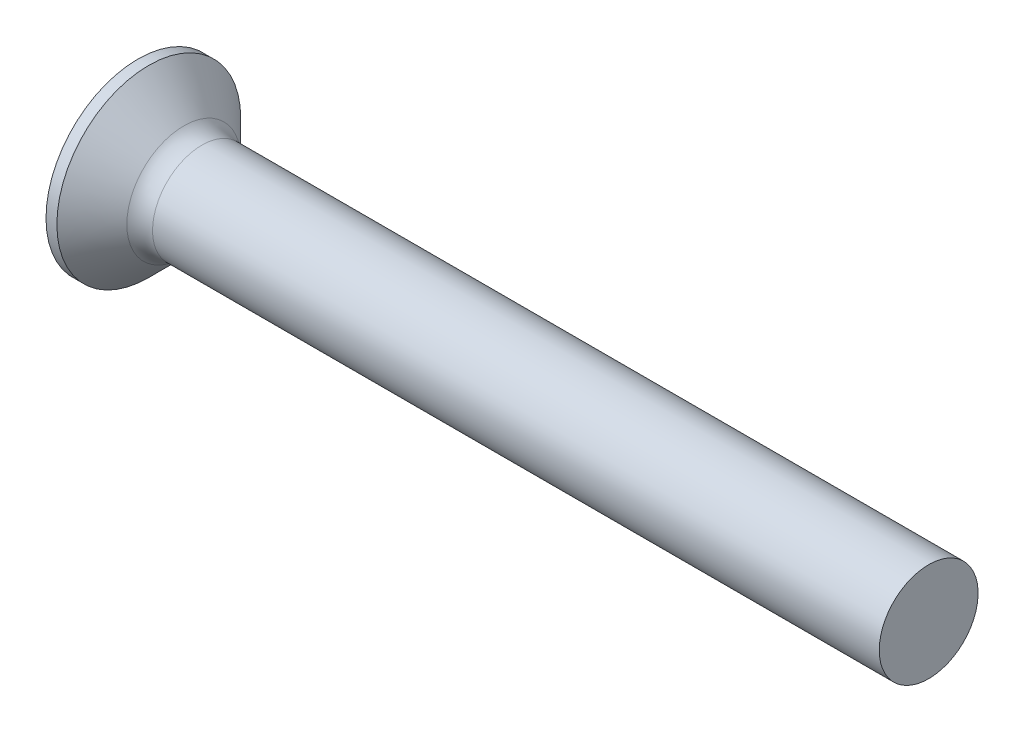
SolidWorks part; units mm, degrees
ref_plane "Plane1" through (0, 0, 0) normal (0, 0, 1) x (1, 0, 0)
ref_plane "Plane2" through (0, 0, 0) normal (0, 1, 0) x (1, 0, 0)
ref_plane "Plane3" through (0, 0, 0) normal (1, 0, 0) x (0, 0, -1)
sketch "BodySke" plane through (0, 0, 0) normal (0, 0, 1) x (1, 0, 0)
  line L0 (0, 0) -> (0, 4.65)
  line L1 (0, 4.65) -> (0.55, 4.65)
  line L2 (2.7, 2.5) -> (40, 2.5)
  line L3 (40, 2.5) -> (40, 0)
  line L4 (40, 0) -> (0, 0)
  line L5 (-6.35, 0) -> (82.55, 0) construction
  line L6 (2.7, -2.5) -> (40, -2.5) construction
  line L7 (0.55, -4.65) -> (2.7, -2.5) construction
  line L8 (0.55, 4.65) -> (2.7, 2.5)
  line L9 (0, -4.65) -> (0.55, -4.65) construction
  line L10 (3.5, 4.0875) -> (3.5, -5.4375) construction
  line L11 (0, 6.35) -> (0, -3.175) construction
  dimension "Diameter" = 5
  dimension "Length" = 40
  dimension "Head_ht" = 2.7
  dimension "Head_dia" = 9.3
  dimension "Head_ang" = 90
  dimension "D6" = 0.55
  dimension "Advance" = 0.8
  dimension "Thread_nom" = 40
revolve "Base-Revolve" add sketch "BodySke"
fillet "Fillet1" radius 1.3 1 edges at (2.7, 0, 2.5)
sketch "Sketch3" plane through (0, 0, 0) normal (-1, 0, 0) x (0, 0, 1)
  line L0 (-0.515, 2.45) -> (0.515, 2.45)
  line L1 (0.515, 2.45) -> (0.515, -2.45)
  line L2 (0.515, -2.45) -> (-0.515, -2.45)
  line L3 (-0.515, -2.45) -> (-0.515, 2.45)
  dimension "D1" = 2.45
  dimension "Cross_dia" = 4.9
  dimension "D2" = 0.515
  dimension "Cross_width" = 1.03
ref_plane "Plane4" through (3.05, 0, 0) normal (-1, 0, 0) x (0, 0, 1)
sketch "Sketch4" plane through (3.05, 0, 0) normal (-1, 0, 0) x (0, 0, 1)
  line L0 (-0.515, 0.9293) -> (0.515, 0.9293)
  line L3 (0.515, 0.9293) -> (0.515, -0.9293)
  line L4 (0.515, -0.9293) -> (-0.515, -0.9293)
  line L5 (-0.515, -0.9293) -> (-0.515, 0.9293)
  dimension "D1" = 1.03
  dimension "D2" = 1.8587
  dimension "D3" = 0.515
  dimension "D4" = 0.9293
loft "Recess" cut profiles "Sketch3", "Sketch4"
pattern_circular "RecPat" count 2 every 90 about axis through (0, 0, 0) along (1, 0, 0) of "Recess"
sketch "RecCorSke" plane through (0, 0, 0) normal (0, 0, 1) x (1, 0, 0)
  line L0 (-3.175, 0) -> (15.875, 0) construction
  line L2 (0, 0) -> (0, 1.0643)
  line L3 (0, 1.0643) -> (3.05, 0.851)
  line L4 (3.05, 0.851) -> (3.3265, 0)
  line L5 (3.3265, 0) -> (0, 0)
  dimension "Diameter" = 1.702
  dimension "Depth" = 3.05
  dimension "Draft_angle" = 4
  dimension "Bottom_angle" = 18
revolve "RecessCore" cut sketch "RecCorSke" angle 360 about L0
sketch "ThdSchSke" plane through (0, 0, 0) normal (0, 0, 1) x (1, 0, 0)
  line L0 (3.5, -2.055) -> (3.1884, -2.5)
  line L1 (3.5, -2.055) -> (3.8116, -2.5)
  line L2 (3.8116, -2.5) -> (3.8116, -3.125)
  line L3 (-3.175, 0) -> (5.1513, 0) construction
  line L5 (3.8116, -3.125) -> (3.1884, -3.125)
  line L6 (3.1884, -3.125) -> (3.1884, -2.5)
  line L7 (0, 4.65) -> (0, -4.65) construction
  dimension "Thread_minor" = 4.11
  dimension "Diameter" = 5
  dimension "Start" = 3.5
  dimension "SideAngle" = 55
  dimension "VeeAngle" = 70
  dimension "Overcut" = 6.25
revolve "ThreadSchematic" [suppressed] cut sketch "ThdSchSke" angle 360 about L3
pattern_linear "ThdSchPat" [suppressed]
equation "\"D1@Sketch3\" = \"Cross_dia@Sketch3\" / 2"
equation "\"D2@Sketch3\" = \"Cross_width@Sketch3\" / 2"
equation "\"Depth@RecCorSke\" = \"Cross_depth@Plane4\""
equation "\"D1@Sketch4\" = \"Cross_width@Sketch3\""
equation "\"D2@Sketch4\" = \"Cross_dia@Sketch3\" - 2.0 * \"Cross_depth@Plane4\" * tan(26.5  * 0.017453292)"
equation "\"D3@Sketch4\" = \"D1@Sketch4\" / 2"
equation "\"D4@Sketch4\" = \"D2@Sketch4\" / 2"
equation "\"Thread_length@ThreadCosmetic\" = ((sgn( (\"Length@BodySke\" - \"Advance@BodySke\" * 1.0 - \"Head_ht@BodySke\" ) - \"Thread_nom@BodySke\" )-1)*( (\"Length@BodySke\" - \"Advance@BodySke\" * 1.0 - \"Head_ht@BodySke\" "
equation "\"Thread_minor@ThdSchSke\" = \"Thread_minor@ThreadCosmetic\""
equation "\"Diameter@ThdSchSke\" = \"Diameter@BodySke\""
equation "\"Overcut@ThdSchSke\" = \"Diameter@BodySke\" * 1.25"
equation "\"Start@ThdSchSke\" = 0.000001 + \"Length@BodySke\" - \"Thread_length@ThreadCosmetic\"  '---Countersunk---"
equation "\"Num_threads@ThdSchPat\" = int( \"Thread_length@ThreadCosmetic\" / \"Advance@BodySke\" + 0.999 )  + 1"
equation "\"Advance@ThdSchPat\" = \"Thread_length@ThreadCosmetic\" /  (\"Num_threads@ThdSchPat\" - 1) 'relax it"
